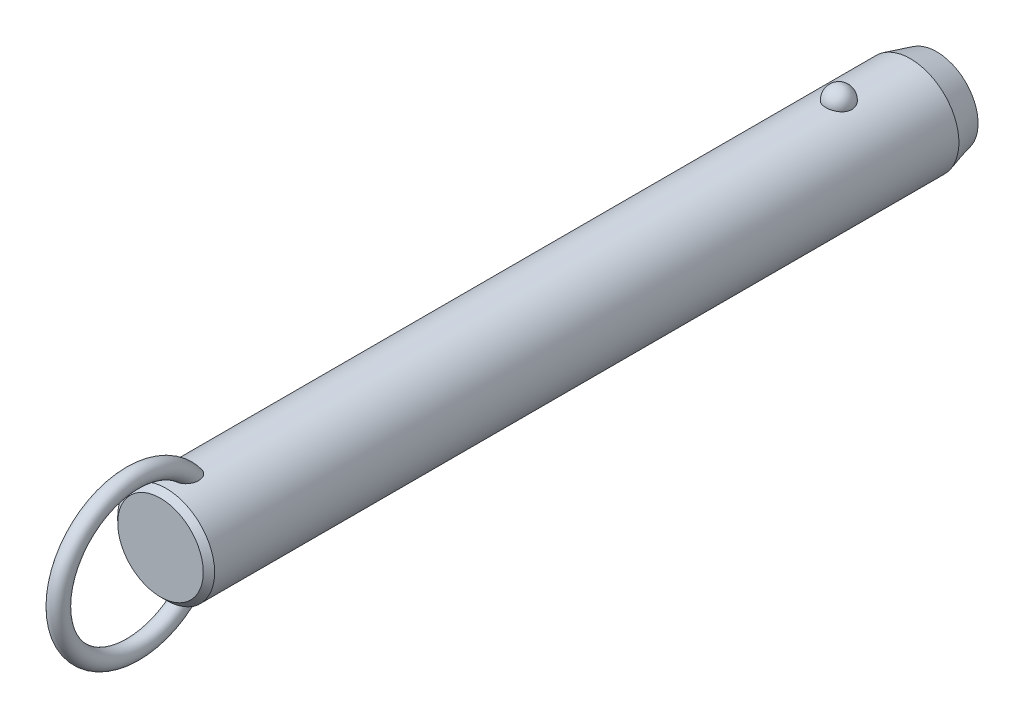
SolidWorks part; units mm, degrees
ref_plane "Front Plane" through (0, 0, 0) normal (0, 0, 1) x (1, 0, 0)
ref_plane "Top Plane" through (0, 0, 0) normal (0, 1, 0) x (1, 0, 0)
ref_plane "Right Plane" through (0, 0, 0) normal (1, 0, 0) x (0, 0, -1)
sketch "Sketch2" plane through (0, 0, 0) normal (0, 0, 1) x (1, 0, 0)
  circle A0 centre (0, 0) radius 11.1
  point P3 (0, 11.1)
  dimension "D1" = 22.2
extrude "Boss-Extrude1" add sketch "Sketch2" along normal blind 139.7
sketch "Sketch3" plane through (0, 0, 0) normal (0, 0, -1) x (-1, 0, 0)
  circle A0 centre (0, 0) radius 11.1
  dimension "D1" = 22.2
extrude "Boss-Extrude2" add sketch "Sketch3" along normal blind 25.4
chamfer "Chamfer1" distance 6 angle 15 1 edges at (-11.1, 0, -25.4)
sketch "Sketch12" plane through (0, 0, 0) normal (1, 0, 0) x (0, 0, -1)
  line L0 (-139.7, 11.1) -> (-139.7, -11.1) construction
  point P0 (-139.7, 0)
sketch "Sketch13" plane through (0, 0, 0) normal (1, 0, 0) x (0, 0, -1)
  circle A0 centre (-158.75, 0) radius 19.05
  point P2 (-139.7, 0)
  dimension "D1" = 38.1
sketch "Sketch14" plane through (0, 0, 0) normal (0, 1, 0) x (1, 0, 0)
  circle A0 centre (0, -141.7) radius 2
  point P2 (0, -139.7)
  dimension "D1" = 4
sweep "Sweep1" add profiles "Sketch14" path "Sketch13"
sketch "Sketch15" plane through (0, 0, 139.7) normal (0, 0, 1) x (1, 0, 0)
  circle A0 centre (0, 0) radius 11.1
  dimension "D1" = 22.2
extrude "Boss-Extrude3" add sketch "Sketch15" along normal blind 12.7
chamfer "Chamfer2" distance 1.3 angle 45 1 edges at (11.1, 0, 152.4)
sketch "Sketch18" plane through (0, 0, 0) normal (1, 0, 0) x (0, 0, -1)
  line L0 (19.4, 11.1) -> (-143.268, 11.1) construction
  line L1 (3, 14.1) -> (3, 8.1)
  line L2 (-143.268, -11.1) -> (19.4, -11.1) construction
  arc A0 (3, 14.1) -> (3, 8.1) centre (3, 11.1) ccw
  point P4 (0, 11.1)
  dimension "D1" = 25.2
revolve "Revolve1" add sketch "Sketch18" angle 360 about L1
